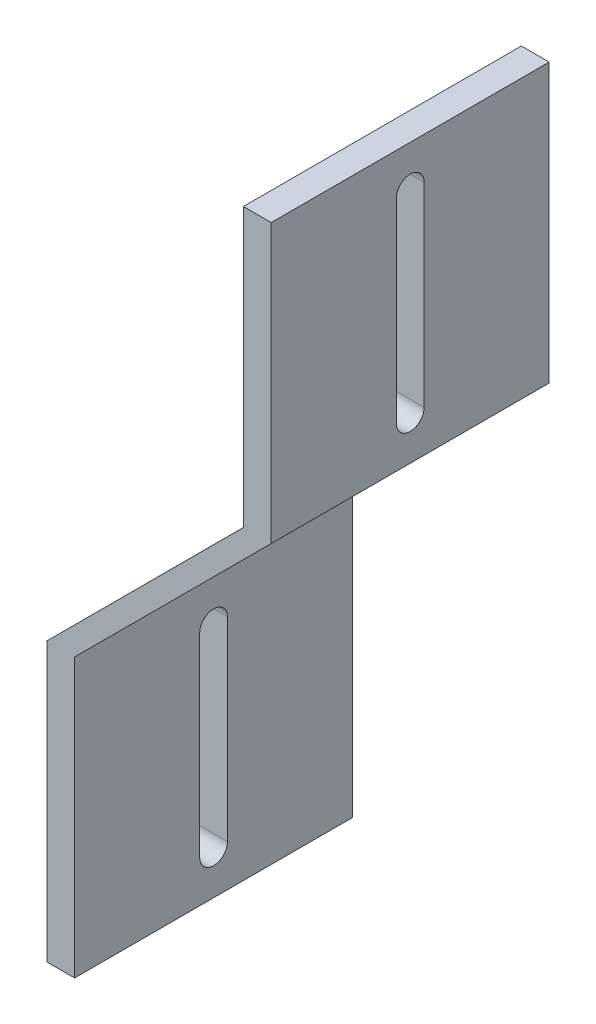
SolidWorks part; units mm, degrees
ref_plane "Front Plane" through (0, 0, 0) normal (0, 0, 1) x (1, 0, 0)
ref_plane "Top Plane" through (0, 0, 0) normal (0, 1, 0) x (1, 0, 0)
ref_plane "Right Plane" through (0, 0, 0) normal (1, 0, 0) x (0, 0, -1)
sketch "Sketch1" plane through (0, 0, 0) normal (0, 0, 1) x (1, 0, 0)
  line L0 (12.027, 39.628) -> (47.9535, 75.5436)
  line L2 (6.947, 39.628) -> (6.947, -11.172)
  line L3 (6.947, -11.172) -> (12.027, -11.172)
  line L4 (12.027, 39.628) -> (12.027, -11.172)
  line L5 (6.947, 39.628) -> (12.027, -11.172) construction
  line L6 (6.947, -11.172) -> (12.027, 39.628) construction
  line L7 (6.947, 39.628) -> (42.8735, 75.5436)
  line L9 (42.8735, 126.3436) -> (47.9535, 126.3436)
  line L10 (42.8735, 126.3436) -> (42.8735, 75.5436)
  line L12 (47.9535, 126.3436) -> (47.9535, 75.5436)
  point P0 (9.487, 14.228)
extrude "Boss-Extrude1" add sketch "Sketch1" along normal blind 50.8
sketch "Sketch2" plane through (42.8735, 0, 0) normal (-1, 0, 0) x (0, 0, 1)
  line L0 (0, 126.3436) -> (50.8, 75.5436) construction
  line L1 (0, 75.5436) -> (50.8, 126.3436) construction
  line L2 (25.4, 83.1293) -> (25.4, 118.7578) construction
  line L3 (22.86, 83.1293) -> (22.86, 118.7578)
  line L4 (27.94, 83.1293) -> (27.94, 118.7578)
  arc A0 (22.86, 83.1293) -> (27.94, 83.1293) centre (25.4, 83.1293) ccw
  arc A1 (27.94, 118.7578) -> (22.86, 118.7578) centre (25.4, 118.7578) ccw
  point P10 (25.4, 100.9436)
  dimension "D1" = 2.54
extrude "Cut-Extrude1" cut sketch "Sketch2" against normal blind 5.08
sketch "Sketch3" plane through (6.947, 0, 0) normal (-1, 0, 0) x (0, 0, 1)
  line L0 (0, 39.628) -> (50.8, -11.172) construction
  line L1 (0, -11.172) -> (4.0088, -7.1632) construction
  line L2 (50.8, 39.628) -> (0, -11.172) construction
  line L3 (25.4, -3.552) -> (25.4, 32.008) construction
  line L4 (22.86, -3.552) -> (22.86, 32.008)
  line L5 (27.94, -3.552) -> (27.94, 32.008)
  arc A0 (22.86, -3.552) -> (27.94, -3.552) centre (25.4, -3.552) ccw
  arc A1 (27.94, 32.008) -> (22.86, 32.008) centre (25.4, 32.008) ccw
  point P11 (25.4, 14.228)
  dimension "D1" = 2.54
  dimension "D2" = 35.56
extrude "Cut-Extrude2" cut sketch "Sketch3" against normal blind 5.08
